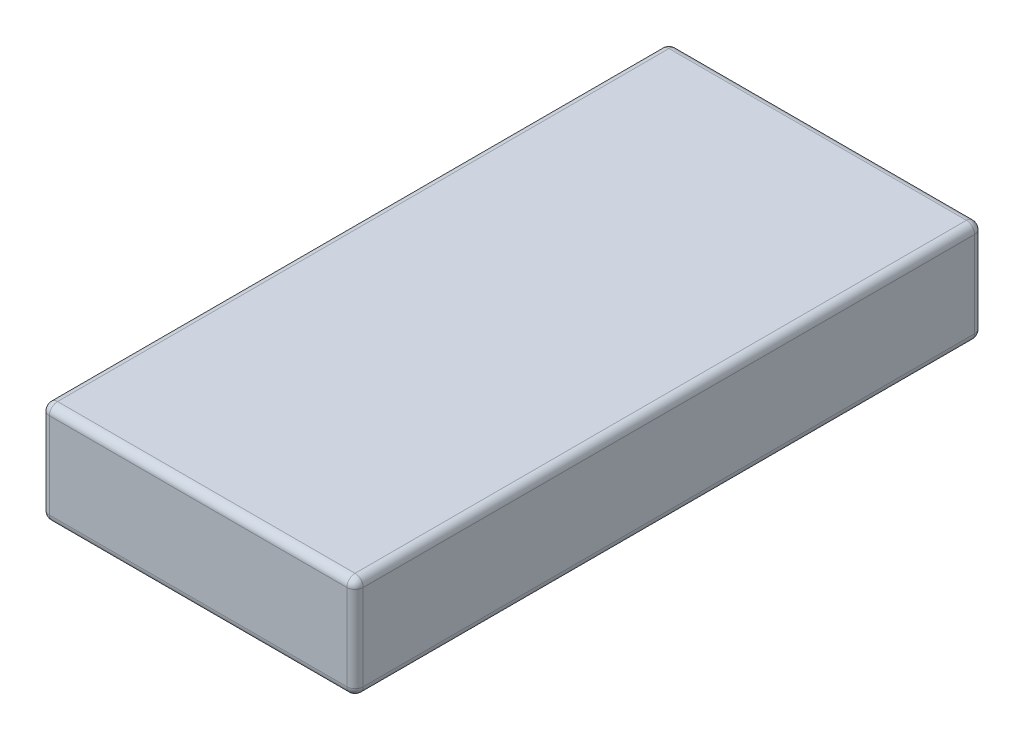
SolidWorks part; units mm, degrees
ref_plane "Front Plane" through (0, 0, 0) normal (0, 0, 1) x (1, 0, 0)
ref_plane "Top Plane" through (0, 0, 0) normal (0, 1, 0) x (1, 0, 0)
ref_plane "Right Plane" through (0, 0, 0) normal (1, 0, 0) x (0, 0, -1)
sketch "Sketch1" plane through (0, 0, 0) normal (0, 0, 1) x (1, 0, 0)
  line L1 (-57.5, 18.75) -> (57.5, 18.75)
  line L2 (-57.5, 18.75) -> (-57.5, -18.75)
  line L3 (-57.5, -18.75) -> (57.5, -18.75)
  line L4 (57.5, 18.75) -> (57.5, -18.75)
  line L5 (-57.5, 18.75) -> (57.5, -18.75) construction
  line L6 (-57.5, -18.75) -> (57.5, 18.75) construction
  point P0 (0, 0)
  dimension "D1" = 37.5
  dimension "D2" = 115
extrude "Boss-Extrude1" add sketch "Sketch1" along normal mid plane 230
fillet "Fillet1" radius 3 12 edges at (-57.5, 0, -115) (-57.5, -18.75, 0) (0, -18.75, -115) (0, -18.75, 115) (-57.5, 0, 115) (57.5, -18.75, 0) (57.5, 0, 115) (57.5, 0, -115) (57.5, 18.75, 0) (0, 18.75, 115) (-57.5, 18.75, 0) (0, 18.75, -115)
